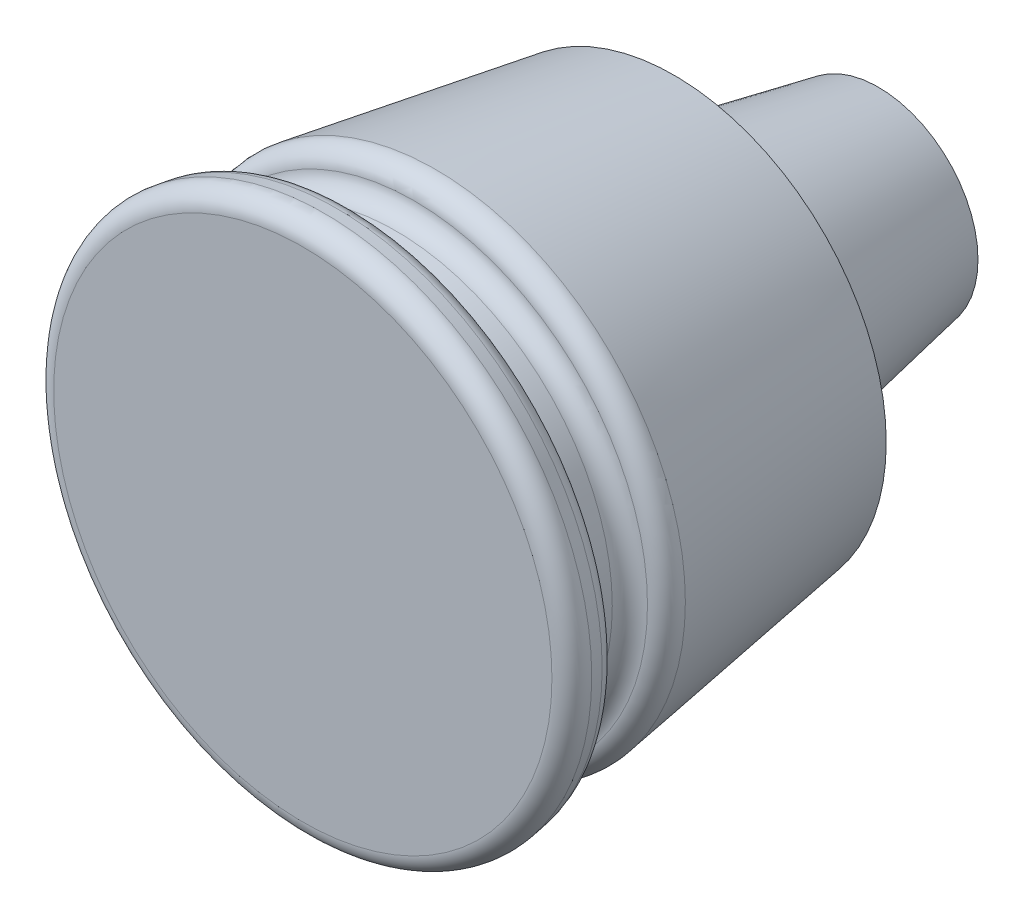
SolidWorks part; units mm, degrees
ref_plane "Plan de face" through (0, 0, 0) normal (0, 0, 1) x (1, 0, 0)
ref_plane "Plan de dessus" through (0, 0, 0) normal (0, 1, 0) x (1, 0, 0)
ref_plane "Plan de droite" through (0, 0, 0) normal (1, 0, 0) x (0, 0, -1)
sketch "Esquisse1" plane through (0, 0, 0) normal (0, 0, 1) x (1, 0, 0)
  circle A0 centre (0, 0) radius 22.5
  dimension "D1" = 45
extrude "Boss.-Extru.1" add sketch "Esquisse1" against normal up to surface (33 mm away) draft 11
sketch "Esquisse2" plane through (0, 0, 0) normal (0, 0, 1) x (1, 0, 0)
  circle A0 centre (0, 0) radius 34.259
  dimension "D1" = 68.5181
extrude "Boss.-Extru.2" add sketch "Esquisse2" along normal blind 60 draft 9
sketch "Esquisse3" plane through (0, 0, 0) normal (1, 0, 0) x (0, 0, -1)
  line L1 (0, 0) -> (-32.5184, 0) construction
  line L2 (-45, -35) -> (-49, -35)
  line L3 (-42, -38) -> (-42, -51)
  line L4 (-42, -51) -> (-52, -51)
  line L5 (-52, -38) -> (-52, -51)
  arc A1 (-45, -35) -> (-42, -38) centre (-45, -38) cw
  arc A2 (-49, -35) -> (-52, -38) centre (-49, -38) ccw
  point P7 (-42, -35)
  dimension "D1" = 42
  dimension "D5" = 3
  dimension "D2" = 10
  dimension "D3" = 16
  dimension "D4" = 35
revolve "Enlèvement de matière-Révolution1" cut sketch "Esquisse3" angle 360 about L1
fillet "Congé1" radius 3 3 edges at (40.9112, 0, 42) (-42.495, 0, 52) (43.7621, 0, 60)
